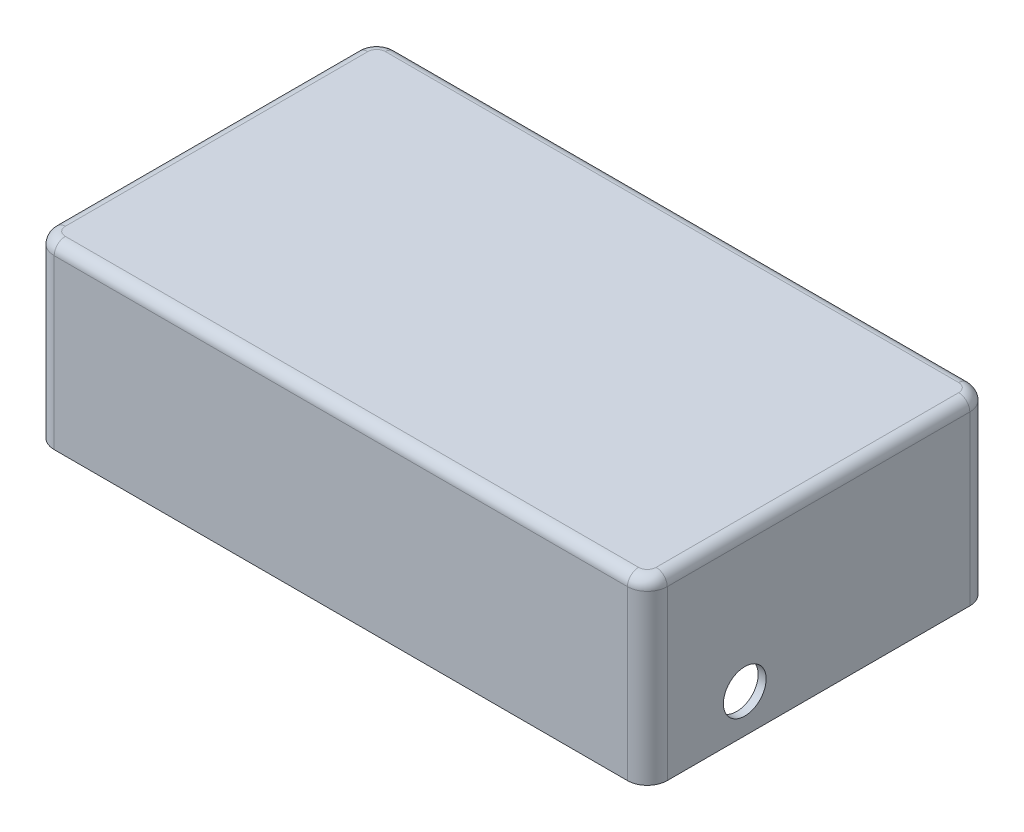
SolidWorks part; units mm, degrees
ref_plane "Front Plane" through (0, 0, 0) normal (0, 0, 1) x (1, 0, 0)
ref_plane "Top Plane" through (0, 0, 0) normal (0, 1, 0) x (1, 0, 0)
ref_plane "Right Plane" through (0, 0, 0) normal (1, 0, 0) x (0, 0, -1)
sketch "Sketch1" plane through (0, 0, 0) normal (0, 1, 0) x (1, 0, 0)
  line L0 (-97.79, 54.61) -> (97.79, -54.61) construction
  line L1 (-97.79, 54.61) -> (97.79, 54.61)
  line L2 (-97.79, 54.61) -> (-97.79, -54.61)
  line L3 (-97.79, -54.61) -> (97.79, -54.61)
  line L4 (97.79, 54.61) -> (97.79, -54.61)
  dimension "D1" = 109.22
  dimension "D2" = 195.58
extrude "Boss-Extrude1" add sketch "Sketch1" along normal blind 57.15
fillet "Fillet1" radius 3.556 4 edges at (0, 57.15, -54.61) (-97.79, 57.15, 0) (0, 57.15, 54.61) (97.79, 57.15, 0)
fillet "Fillet2" radius 6.35 8 edges at (96.7485, 56.1085, 53.5685) (96.7485, 56.1085, -53.5685) (-96.7485, 56.1085, -53.5685) (-96.7485, 56.1085, 53.5685) (-97.79, 26.797, 54.61) (-97.79, 26.797, -54.61) (97.79, 26.797, -54.61) (97.79, 26.797, 54.61)
shell "Shell1" thickness 2.54
sketch "Sketch3" plane through (97.79, 0, 0) normal (1, 0, 0) x (0, 0, -1)
  circle A0 centre (-23.5333, 12.3054) radius 6.8235
extrude "Cut-Extrude1" cut sketch "Sketch3" against normal blind 2.54
